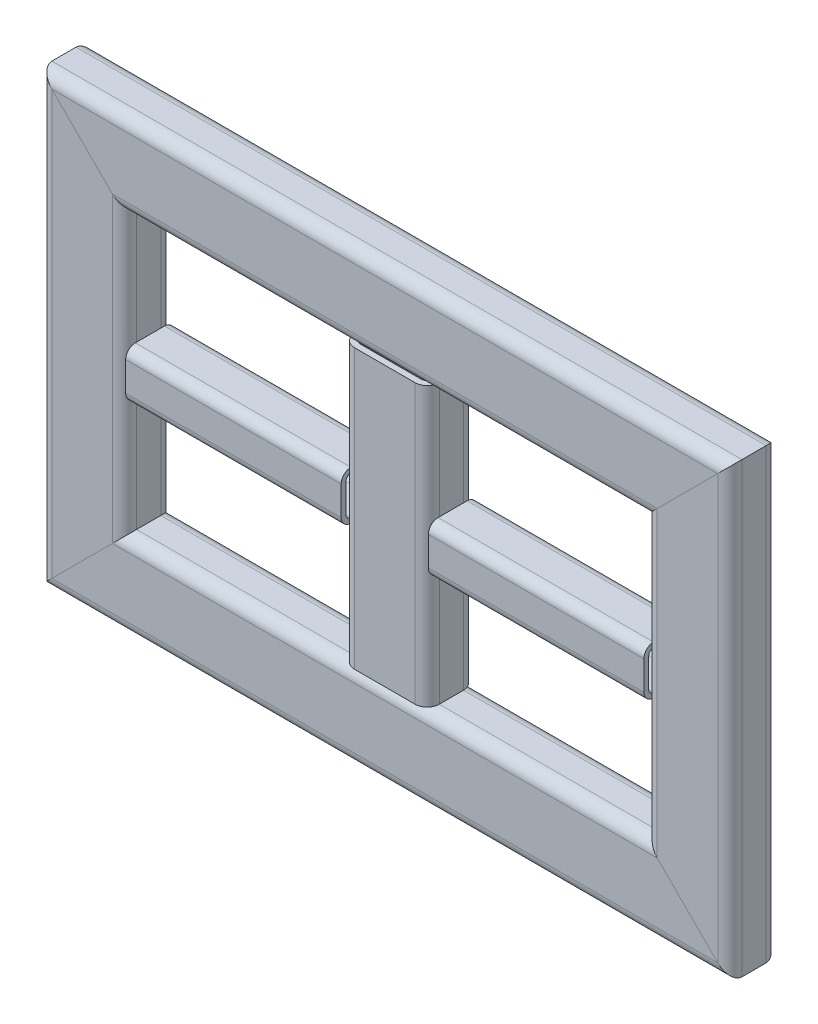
SolidWorks part; units mm, degrees
ref_plane "Płaszczyzna przednia" through (0, 0, 0) normal (0, 0, 1) x (1, 0, 0)
ref_plane "Płaszczyzna górna" through (0, 0, 0) normal (0, 1, 0) x (1, 0, 0)
ref_plane "Płaszczyzna prawa" through (0, 0, 0) normal (1, 0, 0) x (0, 0, -1)
sketch "Szkic1" plane through (0, 0, 0) normal (0, 0, 1) x (1, 0, 0)
  line L0 (0, 150) -> (0, -150)
  line L1 (250, -150) -> (-250, -150)
  line L2 (250, -150) -> (250, 150)
  line L3 (250, 150) -> (-250, 150)
  line L4 (-250, -150) -> (-250, 150)
  line L5 (250, -150) -> (-250, 150) construction
  line L6 (250, 150) -> (-250, -150) construction
  line L7 (-250, 0) -> (250, 0)
  point P0 (0, 0)
  dimension "D1" = 300
  dimension "D2" = 500
other "Rura prostokątna 70 X 40 X 5(1)"
ref_plane "Płaszczyzna1" through (-250, -150, 0) normal (0, 1, 0) x (0, 0, 1)
sketch "Sketch1" plane through (-250, -150, 0) normal (0, 1, 0) x (0, 0, 1)
  line L0 (-10, -30) -> (10, -30)
  line L1 (-15, -25) -> (-15, 25)
  line L2 (10, 30) -> (-10, 30)
  line L3 (15, 25) -> (15, -25)
  line L4 (-10, -35) -> (10, -35)
  line L5 (-20, -25) -> (-20, 25)
  line L6 (10, 35) -> (-10, 35)
  line L7 (20, 25) -> (20, -25)
  arc A0 (20, 25) -> (10, 35) centre (10, 25) ccw
  arc A1 (10, -35) -> (20, -25) centre (10, -25) ccw
  arc A2 (-20, -25) -> (-10, -35) centre (-10, -25) ccw
  arc A3 (-10, 35) -> (-20, 25) centre (-10, 25) ccw
  arc A4 (-10, 30) -> (-15, 25) centre (-10, 25) ccw
  arc A5 (15, 25) -> (10, 30) centre (10, 25) ccw
  arc A6 (10, -30) -> (15, -25) centre (10, -25) ccw
  arc A7 (-15, -25) -> (-10, -30) centre (-10, -25) ccw
  point P0 (0, 35)
  point P1 (20, 0)
  point P2 (0, -35)
  point P3 (-20, 0)
  point P4 (-20, 35)
  point P5 (20, 35)
  point P6 (20, -35)
  point P7 (-20, -35)
  point P8 (0, 0)
  point P33 (0, 0)
  dimension "D1" = 10
  dimension "Thickness" = 5
  dimension "V_leg" = 70
  dimension "H_leg" = 40
other "Rura kwadratowa 40 X 40 X 4(1)"
ref_plane "Płaszczyzna2" through (-250, 0, 0) normal (1, 0, 0) x (0, 1, 0)
sketch "Sketch11" plane through (-250, 0, 0) normal (1, 0, 0) x (0, 1, 0)
  line L0 (-12, -16) -> (12, -16)
  line L1 (-16, -12) -> (-16, 12)
  line L2 (12, 16) -> (-12, 16)
  line L3 (16, 12) -> (16, -12)
  line L4 (-12, -20) -> (12, -20)
  line L5 (-20, -12) -> (-20, 12)
  line L6 (12, 20) -> (-12, 20)
  line L7 (20, 12) -> (20, -12)
  arc A0 (20, 12) -> (12, 20) centre (12, 12) ccw
  arc A1 (12, -20) -> (20, -12) centre (12, -12) ccw
  arc A2 (-20, -12) -> (-12, -20) centre (-12, -12) ccw
  arc A3 (-12, 20) -> (-20, 12) centre (-12, 12) ccw
  arc A4 (-12, 16) -> (-16, 12) centre (-12, 12) ccw
  arc A5 (16, 12) -> (12, 16) centre (12, 12) ccw
  arc A6 (12, -16) -> (16, -12) centre (12, -12) ccw
  arc A7 (-16, -12) -> (-12, -16) centre (-12, -12) ccw
  point P0 (-20, 0)
  point P1 (20, 0)
  point P2 (0, 20)
  point P3 (0, -20)
  point P4 (0, 0)
  point P5 (-20, -20)
  point P6 (20, -20)
  point P7 (20, 20)
  point P8 (-20, 20)
  point P33 (0, 0)
  dimension "D1" = 8
  dimension "Thickness" = 4
  dimension "V_leg" = 40
other "Przytnij/Wydłuż1"
